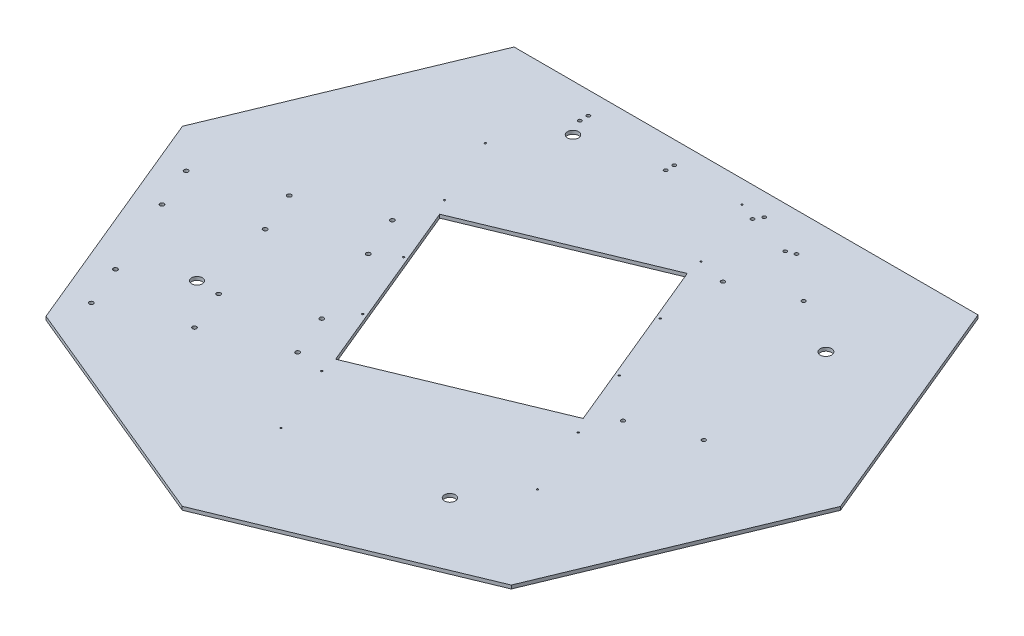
SolidWorks part; units mm, degrees
ref_plane "Plan de face" through (0, 0, 0) normal (0, 0, 1) x (1, 0, 0)
ref_plane "Plan de dessus" through (0, 0, 0) normal (0, 1, 0) x (1, 0, 0)
ref_plane "Plan de droite" through (0, 0, 0) normal (1, 0, 0) x (0, 0, -1)
sketch "Esquisse1" plane through (0, 0, 0) normal (0, 1, 0) x (1, 0, 0)
  line L0 (-675.581, 683.2786) -> (675.8154, 683.2786)
  line L1 (-958.7214, 0.2786) -> (-678.1154, -677.7214)
  line L2 (-678.1154, -677.7214) -> (-0.2786, -958.7214)
  line L3 (-0.2786, -958.7214) -> (677.7214, -678.1154)
  line L4 (677.7214, -678.1154) -> (958.7214, -0.2786)
  line L5 (958.7214, -0.2786) -> (675.8154, 683.2786)
  line L6 (0, -1175.1935) -> (0, 1187.2384) construction
  line L7 (-958.7214, 0.2786) -> (958.7214, -0.2786) construction
  line L8 (-675.581, 683.2786) -> (-958.7214, 0.2786)
  line L9 (-147.9453, -364.2639) -> (-362.0976, 153.1709)
  line L10 (-147.9453, -364.2639) -> (362.0976, -153.1709)
  line L11 (-373.5507, 804.0035) -> (-580.9141, 718.1814)
  line L12 (688.6996, 673.3337) -> (341.0217, 817.4649)
  line L13 (-362.0976, 153.1709) -> (147.9453, 364.2639)
  line L14 (362.0976, -153.1709) -> (147.9453, 364.2639)
  line L15 (-147.9453, -364.2639) -> (147.9453, 364.2639) construction
  line L16 (-362.0976, 153.1709) -> (362.0976, -153.1709) construction
  line L17 (768.1613, 768.1613) -> (-930.1134, -930.1134) construction
  line L18 (-840.7635, -106.9138) -> (-645.7319, -578.149) construction
  line L19 (220.5581, 395.3987) -> (386.8764, 464.2334) construction
  line L20 (220.5581, 395.3987) -> (425.9149, -100.7843) construction
  line L21 (425.9149, -100.7843) -> (592.2332, -31.9496) construction
  line L22 (386.8764, 464.2334) -> (592.2332, -31.9496) construction
  line L23 (-840.7635, -106.9138) -> (-415.7278, 68.9971) construction
  line L24 (-645.7319, -578.149) -> (-220.6962, -402.2382) construction
  line L25 (-415.7278, 68.9971) -> (-220.6962, -402.2382) construction
  line L26 (-628.2457, -18.9583) -> (-433.2141, -490.1936) construction
  line L27 (-791.0496, -227.0326) -> (-366.0139, -51.1217) construction
  line L28 (-270.4101, -282.1194) -> (-695.4459, -458.0302) construction
  line L29 (-474.5896, 398.8242) -> (53.9331, 617.5656) construction
  line L30 (-474.5896, 398.8242) -> (-53.9331, -617.5656) construction
  line L31 (53.9331, 617.5656) -> (474.5896, -398.8242) construction
  line L32 (-53.9331, -617.5656) -> (474.5896, -398.8242) construction
  line L33 (-210.3282, 508.1949) -> (210.3282, -508.1949) construction
  line L34 (-264.2613, -109.3707) -> (264.2613, 109.3707) construction
  line L35 (118, 618.2786) -> (105.5, 596.628) construction
  line L36 (-394, 618.2786) -> (-144, 618.2786) construction
  line L37 (-394, 618.2786) -> (-394, 593.2786) construction
  line L38 (-394, 593.2786) -> (-144, 593.2786) construction
  line L39 (-144, 618.2786) -> (-144, 593.2786) construction
  line L40 (257.8764, 572.4302) -> (234.8638, 562.6619) construction
  circle A0 centre (0, 0) radius 958.7214 construction
  circle A1 centre (0, 0) radius 885.7431 construction
  circle A2 centre (0, 0) radius 280 construction
  circle A3 centre (386.8764, 464.2334) radius 5.5
  circle A4 centre (220.5581, 395.3987) radius 5.5
  circle A5 centre (592.2332, -31.9496) radius 5.5
  circle A6 centre (425.9149, -100.7843) radius 5.5
  circle A7 centre (-578.5317, -139.0771) radius 6
  circle A8 centre (-482.928, -370.0748) radius 6
  circle A9 centre (-791.0496, -227.0326) radius 6
  circle A10 centre (-840.7635, -106.9138) radius 6
  circle A11 centre (-628.2457, -18.9583) radius 6
  circle A12 centre (-415.7278, 68.9971) radius 6
  circle A13 centre (-366.0139, -51.1217) radius 6
  circle A14 centre (-270.4101, -282.1194) radius 6
  circle A15 centre (-220.6962, -402.2382) radius 6
  circle A16 centre (-433.2141, -490.1936) radius 6
  circle A17 centre (-645.7319, -578.149) radius 6
  circle A18 centre (-695.4459, -458.0302) radius 6
  circle A19 centre (257.8764, 572.4302) radius 5
  circle A20 centre (234.8638, 562.6619) radius 5
  circle A21 centre (474.5896, -398.8242) radius 2.5
  circle A22 centre (-53.9331, -617.5656) radius 2.5
  circle A23 centre (118, 618.2786) radius 5
  circle A24 centre (105.5, 596.628) radius 5
  circle A25 centre (-144, 618.2786) radius 5
  circle A26 centre (-144, 593.2786) radius 5
  circle A27 centre (-394, 593.2786) radius 5
  circle A28 centre (-394, 618.2786) radius 5
  dimension "D1" = 683
  dimension "D3" = 281
  dimension "D8" = 180
  dimension "D4" = 560
  dimension "D12" = 11
  dimension "D20" = 12
  dimension "D23" = 5
  dimension "D35" = 10
  dimension "D2" = 678
  dimension "D5" = 560
  dimension "D6" = 552
  dimension "D7" = 45
  dimension "D9" = 537
  dimension "D10" = 256
  dimension "D11" = 355
  dimension "D13" = 79.62
  dimension "D14" = 510
  dimension "D15" = 460
  dimension "D16" = 68
  dimension "D17" = 230
  dimension "D18" = 250
  dimension "D19" = 130
  dimension "D21" = 1100
  dimension "D22" = 572
  dimension "D24" = 144
  dimension "D25" = 250
  dimension "D26" = 65
  dimension "D27" = 25
  dimension "D28" = 118
  dimension "D29" = 60
  dimension "D30" = 25
  dimension "D31" = 25
  dimension "D32" = 23
  dimension "D33" = 150
  dimension "D34" = 129
extrude "Boss.-Extru.1" add sketch "Esquisse1" along normal blind 10
pattern_linear "Répétition linéaire1" count 6 spacing 220 along (-0.3824, 0, -0.924) of "Boss.-Extru.1"
sketch "Esquisse2" plane through (0, 0, 0) normal (0, -1, 0) x (1, 0, 0)
  circle A0 centre (-368.3464, -547.6478) radius 16
  circle A1 centre (547.6478, -368.3464) radius 16.4374
  circle A2 centre (368.3464, 547.6478) radius 15.7638
  circle A3 centre (-547.6478, 368.3464) radius 15.4655
extrude "Enlèv. mat.-Extru.1" cut sketch "Esquisse2" against normal blind 10
